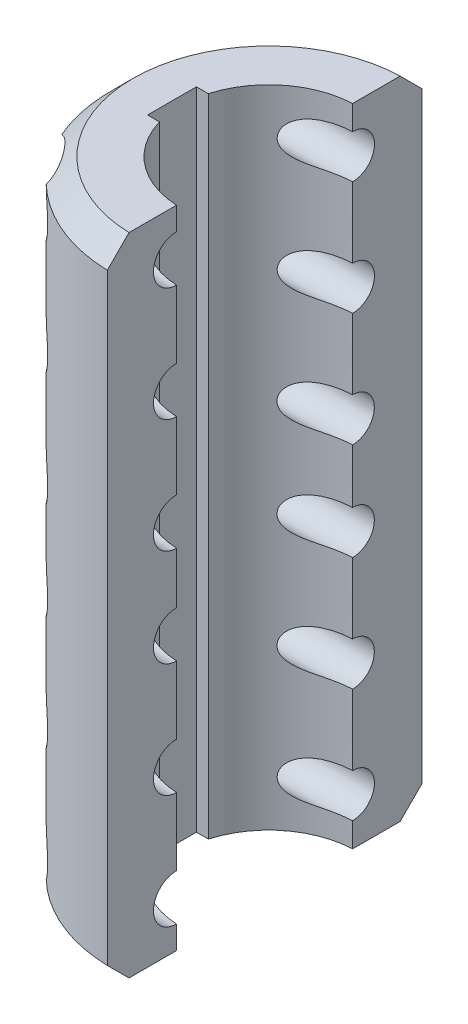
SolidWorks part; units mm, degrees
ref_plane "Plan de face" through (0, 0, 0) normal (0, 0, 1) x (1, 0, 0)
ref_plane "Plan de dessus" through (0, 0, 0) normal (0, 1, 0) x (1, 0, 0)
ref_plane "Plan de droite" through (0, 0, 0) normal (1, 0, 0) x (0, 0, -1)
sketch "Esquisse1" plane through (0, 0, 0) normal (0, 1, 0) x (1, 0, 0)
  line L0 (66.4866, 0) -> (-75.2385, 0) construction
  line L1 (-31.229, -9) -> (-35.629, -9)
  line L2 (-31.229, 9) -> (-35.629, 9)
  line L5 (-35.629, 9) -> (-35.629, -9)
  circle A0 centre (0, 0) radius 58
  arc A1 (-31.229, -9) -> (-31.229, 9) centre (0, 0) ccw
  point P8 (-35.629, 0)
  dimension "D1" = 116
  dimension "D2" = 65
  dimension "D3" = 18
  dimension "D4" = 4.4
extrude "Extrusion1" add sketch "Esquisse1" along normal blind 238
sketch "Esquisse2" plane through (0, 238, 0) normal (0, 1, 0) x (1, 0, 0)
  line L1 (-1.5, 58) -> (69.0392, 58)
  line L2 (-1.5, 58) -> (-1.5, -58)
  line L3 (-1.5, -58) -> (69.0392, -58)
  line L4 (69.0392, 58) -> (69.0392, -58)
  dimension "D1" = 1.5
extrude "Extrusion2" cut sketch "Esquisse2" against normal blind 262
chamfer "Chanfrein1" distance 8 angle 45 2 edges at (-58, 0, 0) (-58, 238, 0)
sketch "Esquisse3" plane through (0, 0, 0) normal (1, 0, 0) x (0, 0, -1)
  line L0 (0, 157.8023) -> (0, -5.185) construction
  line L1 (32.4654, 238) -> (32.4654, 0) construction
  line L3 (9, 0) -> (32.4654, 0) construction
  line L4 (-49.9775, 0) -> (49.9775, 0) construction
  line L5 (32.5, 17) -> (32.5, 247.4862) construction
  circle A0 centre (32.5, 17) radius 8
  circle A1 centre (32.4654, 59) radius 8
  circle A2 centre (32.4654, 101) radius 8
  circle A3 centre (32.4654, 137) radius 8
  circle A4 centre (32.5, 179) radius 8
  circle A5 centre (32.5, 221) radius 8
  dimension "D1" = 16
  dimension "D3" = 16
  dimension "D4" = 16
  dimension "D5" = 16
  dimension "D10" = 16
  dimension "D11" = 16
  dimension "D2" = 65
  dimension "D6" = 137
  dimension "D7" = 17
  dimension "D8" = 59
  dimension "D9" = 101
  dimension "D12" = 179
  dimension "D13" = 221
extrude "Extrusion3" cut sketch "Esquisse3" against normal through all
sketch "Esquisse7" plane through (-1.5, 0, 0) normal (1, 0, 0) x (0, 0, -1)
  line L0 (-32.4654, 0) -> (-32.4654, 238) construction
  line L1 (-32.4654, 0) -> (-49.9775, 0) construction
  line L2 (-32.4654, 17) -> (-32.4654, 254.914) construction
  line L3 (-49.9775, 0) -> (49.9775, 0) construction
  circle A0 centre (-32.4654, 17) radius 8.5
  circle A1 centre (-32.4654, 59) radius 8.5
  circle A2 centre (-32.4654, 101) radius 8.5
  circle A3 centre (-32.4654, 137) radius 8.5
  circle A4 centre (-32.4654, 179) radius 8.5
  circle A5 centre (-32.4654, 221) radius 8.5
  dimension "D1" = 17
  dimension "D8" = 17
  dimension "D9" = 17
  dimension "D10" = 17
  dimension "D11" = 17
  dimension "D12" = 17
  dimension "D2" = 17
  dimension "D3" = 59
  dimension "D4" = 101
  dimension "D5" = 137
  dimension "D6" = 179
  dimension "D7" = 221
extrude "Extrusion4" cut sketch "Esquisse7" against normal blind 30.5
sketch "Esquisse8" plane through (-32, 0, 0) normal (1, 0, 0) x (0, 0, -1)
  circle A0 centre (-32.4654, 101) radius 13
  circle A1 centre (-32.4654, 137) radius 13
  circle A2 centre (-32.4654, 59) radius 13
  circle A3 centre (-32.4654, 17) radius 13
  circle A4 centre (-32.4654, 179) radius 13
  circle A5 centre (-32.4654, 221) radius 13
  dimension "D1" = 26
  dimension "D2" = 26
  dimension "D3" = 26
  dimension "D4" = 26
  dimension "D5" = 26
  dimension "D6" = 26
extrude "Extrusion5" cut sketch "Esquisse8" against normal blind 30.5
